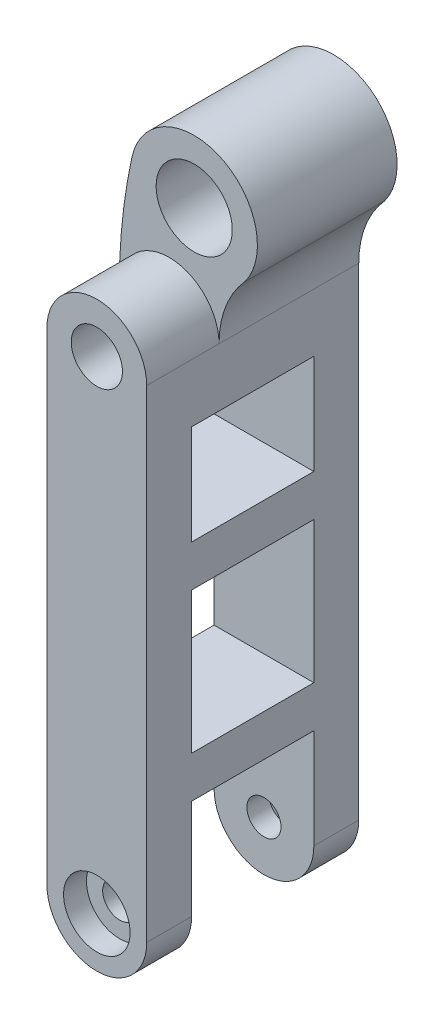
SolidWorks part; units mm, degrees
ref_plane "前视基准面" through (0, 0, 0) normal (0, 0, 1) x (1, 0, 0)
ref_plane "上视基准面" through (0, 0, 0) normal (0, 1, 0) x (1, 0, 0)
ref_plane "右视基准面" through (0, 0, 0) normal (1, 0, 0) x (0, 0, -1)
other "Configuration Table"
sketch "草图1" plane through (0, 0, 0) normal (0, 0, 1) x (1, 0, 0)
  line L2 (0, 0) -> (0, 58)
  line L4 (12, 0) -> (12, 58)
  arc A0 (0, 58) -> (12, 58) centre (6, 58) cw
  arc A1 (12, 0) -> (0, 0) centre (6, 0) cw
  circle A2 centre (6, 58) radius 3.08
  circle A3 centre (6, 0) radius 2.05
  dimension "D1" = 12
  dimension "D2" = 58
extrude "凸台-拉伸7" add sketch "草图1" against normal blind 25.5
sketch "草图6" plane through (12, 0, 0) normal (1, 0, 0) x (0, 0, -1)
  line L1 (5.4, -6) -> (20.1, -6)
  line L2 (5.4, -6) -> (5.4, 12)
  line L3 (5.4, 12) -> (20.1, 12)
  line L4 (20.1, -6) -> (20.1, 12)
  line L5 (0, 0) -> (0, -6) construction
  line L7 (5.4, 17) -> (20.1, 17)
  line L8 (5.4, 17) -> (5.4, 34)
  line L9 (5.4, 34) -> (20.1, 34)
  line L10 (20.1, 17) -> (20.1, 34)
  line L15 (5.4, 39) -> (20.1, 39)
  line L24 (5.4, 39) -> (5.4, 51)
  line L25 (5.4, 51) -> (20.1, 51)
  line L26 (20.1, 39) -> (20.1, 51)
  dimension "D6" = 12
  dimension "D1" = 14.7
  dimension "D2" = 5.4
  dimension "D3" = 5
  dimension "D4" = 5
  dimension "D5" = 17
extrude "切除-拉伸1" cut sketch "草图6" against normal blind 20
ref_plane "中间基准面1" through (0, 0, -12.75) normal (0, 0, -1) x (-1, 0, 0)
sketch "草图8" plane through (0, 0, -12.75) normal (0, 0, -1) x (-1, 0, 0)
  line L0 (-6, 58) -> (-6, 0) construction
  line L1 (-6, 58) -> (-9.0127, 70.646) construction
  line L2 (-12, 58) -> (-12, 56.4998)
  line L3 (-12, 0) -> (-12, 58) construction
  line L4 (-12, 56.4998) -> (-8.2378, 61.5313)
  line L5 (-8.2378, 61.5313) -> (-2.7489, 61.5313)
  line L6 (-2.7489, 61.5313) -> (0, 56.0424)
  line L7 (0, 58) -> (0, 0) construction
  line L8 (0, 56.0424) -> (0, 58)
  circle A0 centre (-9.0127, 70.646) radius 4.58
  circle A1 centre (-9.0127, 70.646) radius 7.65 construction
  arc A4 (-12, 58) -> (-15.0878, 65.9966) centre (-23.8986, 58) ccw
  arc A5 (0, 58) -> (-1.5208, 72.1932) centre (-66.9905, 58) ccw
  arc A6 (-1.5208, 72.1932) -> (-15.0878, 65.9966) centre (-8.9807, 70.5759) ccw
extrude "凸台-拉伸8" add sketch "草图8" along normal blind 12.75 and the other way blind 4.05
sketch "草图9" plane through (0, 0, 0) normal (0, 0, 1) x (1, 0, 0)
  circle A0 centre (6, 0) radius 4
  dimension "D1" = 8
extrude "切除-拉伸2" cut sketch "草图9" against normal blind 2.75
sketch "草图10" plane through (0, 0, -25.5) normal (0, 0, -1) x (-1, 0, 0)
  line L1 (-2, 0) -> (-4, 3.4641)
  line L2 (-4, 3.4641) -> (-8, 3.4641)
  line L3 (-8, 3.4641) -> (-10, 0)
  line L4 (-10, 0) -> (-8, -3.4641)
  line L5 (-8, -3.4641) -> (-4, -3.4641)
  line L6 (-4, -3.4641) -> (-2, 0)
  circle A0 centre (-6, 0) radius 3.4641 construction
  dimension "D1" = 4
extrude "切除-拉伸3" cut sketch "草图10" against normal blind 2.75
